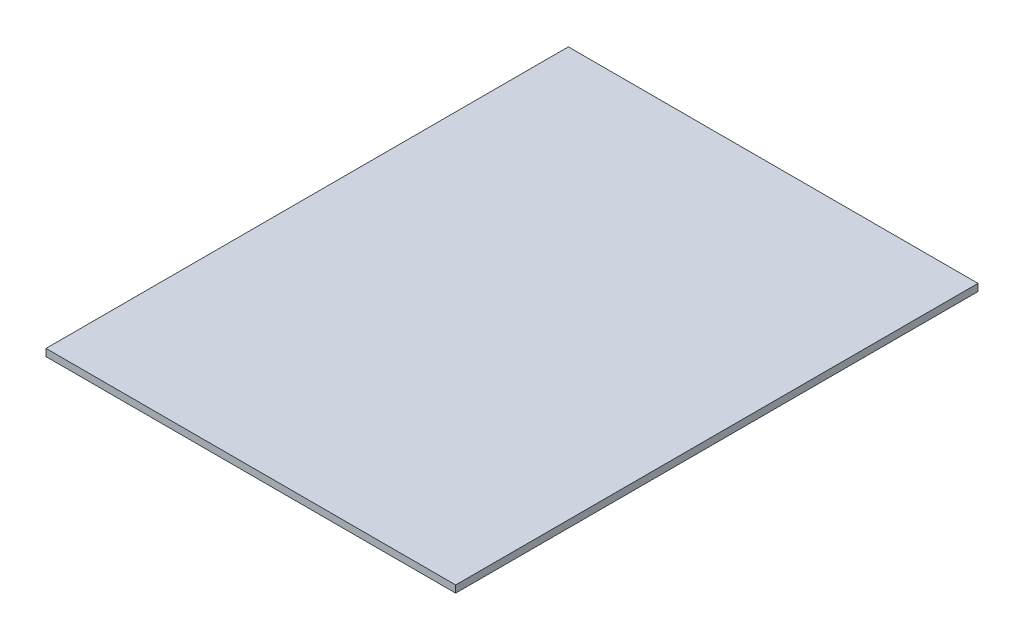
SolidWorks part; units mm, degrees
ref_plane "Front Plane" through (0, 0, 0) normal (0, 0, 1) x (1, 0, 0)
ref_plane "Top Plane" through (0, 0, 0) normal (0, 1, 0) x (1, 0, 0)
ref_plane "Right Plane" through (0, 0, 0) normal (1, 0, 0) x (0, 0, -1)
sketch "Sketch1" plane through (0, 0, 0) normal (0, 1, 0) x (1, 0, 0)
  line L1 (0, 0) -> (146.0183, 0)
  line L2 (0, 0) -> (0, 186.1729)
  line L3 (0, 186.1729) -> (146.0183, 186.1729)
  line L4 (146.0183, 0) -> (146.0183, 186.1729)
extrude "Extrude1" add sketch "Sketch1" along normal blind 2.54
